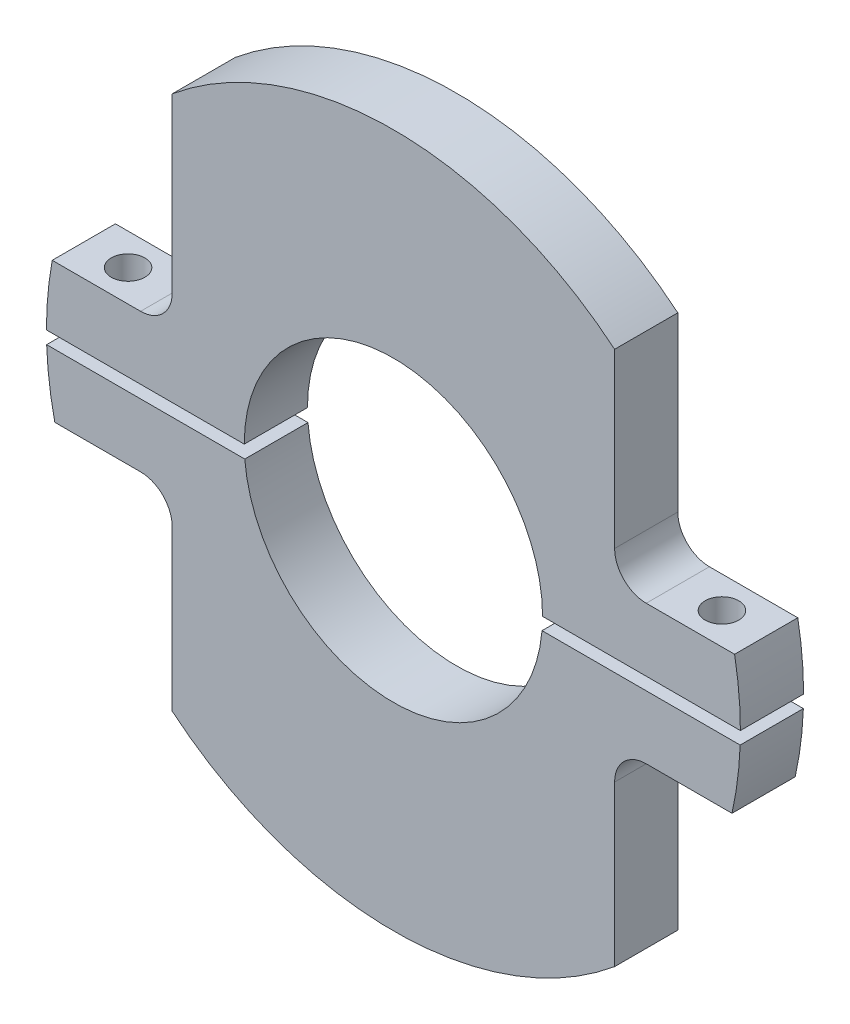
SolidWorks part; units mm, degrees
ref_plane "Front Plane" through (0, 0, 0) normal (0, 0, 1) x (1, 0, 0)
ref_plane "Top Plane" through (0, 0, 0) normal (0, 1, 0) x (1, 0, 0)
ref_plane "Right Plane" through (0, 0, 0) normal (1, 0, 0) x (0, 0, -1)
sketch "Sketch1" plane through (0, 0, 0) normal (0, 0, 1) x (1, 0, 0)
  circle A0 centre (0, 0) radius 29.972
  circle A1 centre (0, 0) radius 69.723
  dimension "D1" = 139.446
  dimension "D2" = 59.944
extrude "Extrude1" add sketch "Sketch1" along normal blind 12.7
sketch "Sketch2" plane through (0, 0, 12.7) normal (0, 0, 1) x (1, 0, 0)
  line L0 (-79.2624, 0) -> (-79.2624, 12.7)
  line L1 (-79.2624, 0) -> (89.9959, 0)
  line L3 (-79.2624, -2.54) -> (89.9959, -2.54)
  line L5 (-79.2624, 12.7) -> (-50.8, 12.7)
  line L6 (-44.45, 19.05) -> (-44.45, 73.8135)
  line L7 (-44.45, 73.8135) -> (-107.7249, 73.8135)
  line L8 (-107.7249, 73.8135) -> (-107.7249, -54.6929)
  line L9 (-107.7249, -54.6929) -> (-44.45, -54.6929)
  line L10 (-44.45, -54.6929) -> (-44.45, -21.59)
  line L11 (-50.8, -15.24) -> (-79.2624, -15.24)
  line L12 (-79.2624, -15.24) -> (-79.2624, -2.54)
  line L13 (89.9959, 0) -> (89.9959, 12.7)
  line L14 (89.9959, 12.7) -> (50.8, 12.7)
  line L15 (44.45, 19.05) -> (44.45, 59.5001)
  line L16 (44.45, 59.5001) -> (103.4639, 59.5001)
  line L17 (103.4639, 59.5001) -> (103.4639, -54.6929)
  line L18 (103.4639, -54.6929) -> (44.45, -54.6929)
  line L19 (44.45, -54.6929) -> (44.45, -21.59)
  line L20 (50.8, -15.24) -> (89.9959, -15.24)
  line L21 (89.9959, -15.24) -> (89.9959, -2.54)
  circle A1 centre (0, 0) radius 69.723 construction
  arc A3 (-50.8, -15.24) -> (-44.45, -21.59) centre (-50.8, -21.59) cw
  arc A4 (50.8, -15.24) -> (44.45, -21.59) centre (50.8, -21.59) ccw
  arc A5 (44.45, 19.05) -> (50.8, 12.7) centre (50.8, 19.05) ccw
  arc A6 (-44.45, 19.05) -> (-50.8, 12.7) centre (-50.8, 19.05) cw
  point P31 (44.45, 12.7)
  dimension "D5" = 44.45
  dimension "D7" = 44.45
  dimension "D8" = 6.35
  dimension "D1" = 2.54
  dimension "D2" = 2.54
  dimension "D3" = 12.7
  dimension "D4" = 12.7
  dimension "D6" = 44.45
extrude "Cut-Extrude1" cut sketch "Sketch2" against normal blind 12.7
sketch "Sketch3" plane through (0, 12.7, 0) normal (0, 1, 0) x (-1, 0, 0)
  line L0 (-50.8, 12.7) -> (-68.5566, 12.7) construction
  line L1 (68.5566, 12.7) -> (50.8, 12.7) construction
  line L2 (68.5566, 12.7) -> (68.5566, 0) construction
  line L3 (-68.5566, 0) -> (-68.5566, 12.7) construction
  circle A0 centre (59.6666, 6.35) radius 3.3782
  circle A1 centre (-59.6666, 6.35) radius 3.3782
  dimension "D1" = 6.7564
  dimension "D2" = 6.7564
  dimension "D3" = 6.35
  dimension "D4" = 6.35
  dimension "D6" = 8.89
  dimension "D5" = 8.89
extrude "Cut-Extrude2" cut sketch "Sketch3" against normal through all
